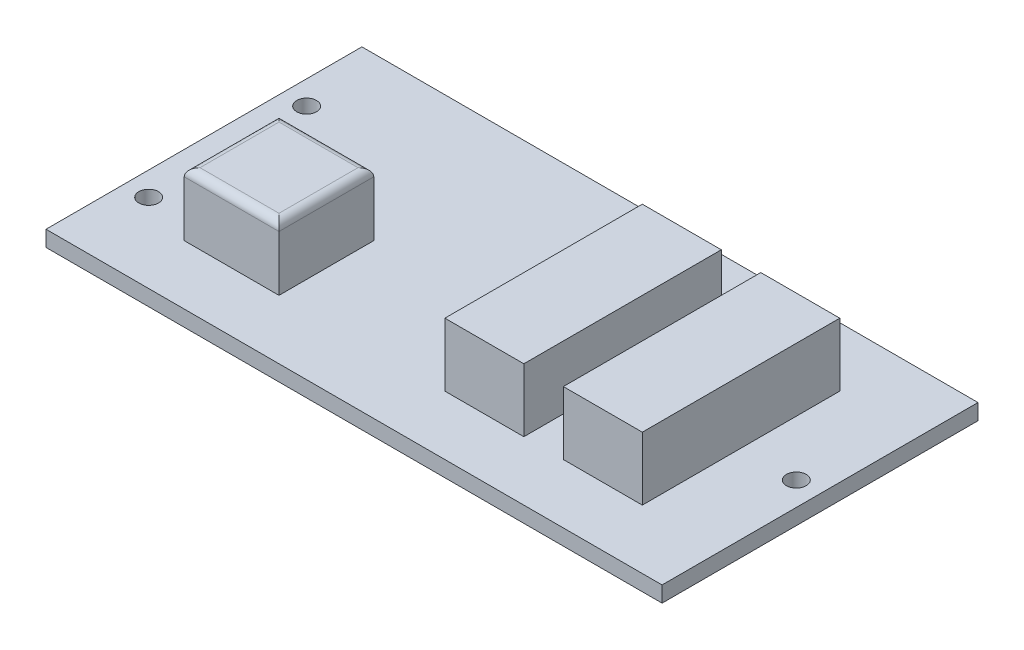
SolidWorks part; units mm, degrees
ref_plane "Front Plane" through (0, 0, 0) normal (0, 0, 1) x (1, 0, 0)
ref_plane "Top Plane" through (0, 0, 0) normal (0, 1, 0) x (1, 0, 0)
ref_plane "Right Plane" through (0, 0, 0) normal (1, 0, 0) x (0, 0, -1)
sketch "Sketch1" plane through (0, 0, 0) normal (0, 1, 0) x (1, 0, 0)
  line L0 (-39, 20) -> (39, -20) construction
  line L1 (-39, 20) -> (39, 20)
  line L2 (-39, 20) -> (-39, -20)
  line L3 (-39, -20) -> (39, -20)
  line L4 (39, 20) -> (39, -20)
  point P4 (0, 0)
  dimension "D1" = 78
  dimension "D2" = 40
extrude "Extrude1" add sketch "Sketch1" along normal blind 2
sketch "Sketch2" plane through (0, 2, 0) normal (0, 1, 0) x (-1, 0, 0)
  line L0 (39, -20) -> (39, 20) construction
  line L1 (-29, -12.5) -> (-19, -12.5)
  line L2 (-29, -12.5) -> (-29, 12.5)
  line L3 (-29, 12.5) -> (-19, 12.5)
  line L4 (-19, -12.5) -> (-19, 12.5)
  line L5 (-14, -12.5) -> (-4, -12.5)
  line L6 (-14, -12.5) -> (-14, 12.5)
  line L7 (-14, 12.5) -> (-4, 12.5)
  line L8 (-4, -12.5) -> (-4, 12.5)
  line L9 (17, 0.5) -> (29, 0.5)
  line L10 (17, 0.5) -> (17, 12.5)
  line L11 (17, 12.5) -> (29, 12.5)
  line L12 (29, 0.5) -> (29, 12.5)
  line L13 (-39, 20) -> (-39, -20) construction
  line L14 (39, 20) -> (-39, 20) construction
  dimension "D1" = 10
  dimension "D2" = 25
  dimension "D3" = 25
  dimension "D4" = 10
  dimension "D5" = 12
  dimension "D6" = 10
  dimension "D7" = 10
  dimension "D8" = 5
  dimension "D9" = 7.5
extrude "Extrude2" add sketch "Sketch2" along normal blind 8
sketch "Sketch3" plane through (0, 2, 0) normal (0, 1, 0) x (-1, 0, 0)
  line L0 (36, -10) -> (36, 10) construction
  line L1 (0, 0) -> (36, 0) construction
  circle A0 centre (-36, 0) radius 1.25
  circle A2 centre (36, 10) radius 1.25
  circle A3 centre (36, -10) radius 1.25
  dimension "D1" = 2.5
  dimension "D2" = 72
  dimension "D3" = 20
  dimension "D4" = 36
extrude "Cut-Extrude2" cut sketch "Sketch3" against normal through all
fillet "Fillet1" radius 1 4 edges at (-17, 10, 6.5) (-23, 10, 0.5) (-29, 10, 6.5) (-23, 10, 12.5)
